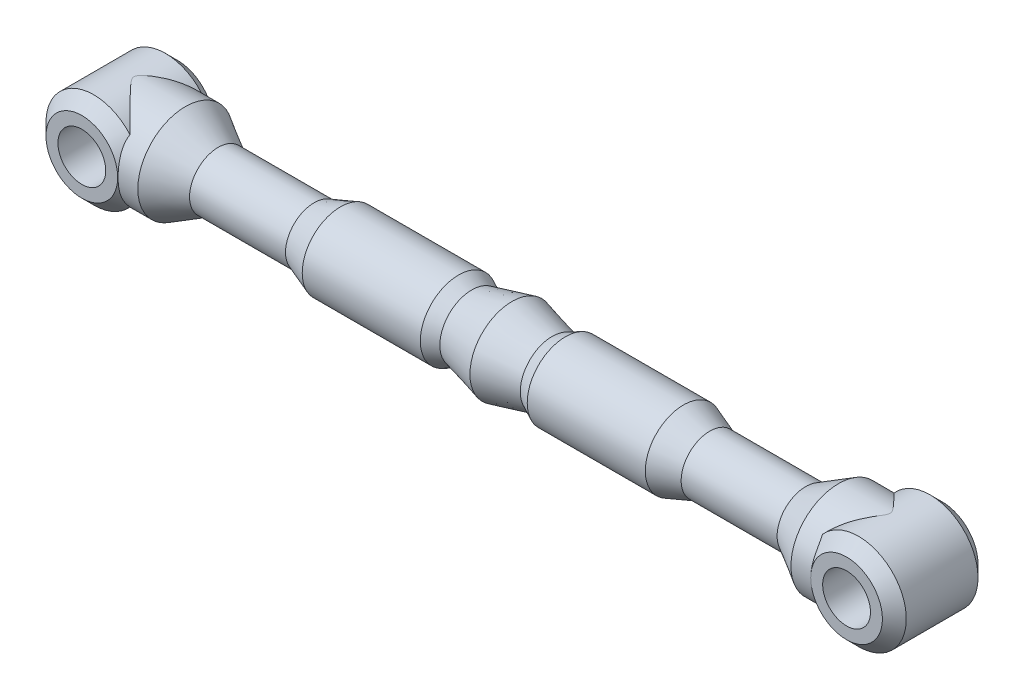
SolidWorks part; units mm, degrees
ref_plane "Front" through (0, 0, 0) normal (0, 0, 1) x (1, 0, 0)
ref_plane "Top" through (0, 0, 0) normal (0, 1, 0) x (1, 0, 0)
ref_plane "Right" through (0, 0, 0) normal (1, 0, 0) x (0, 0, -1)
sketch "Sketch4" plane through (0, 0, 0) normal (0, 0, 1) x (1, 0, 0)
  line L0 (-50.8, 0) -> (50.8, 0)
  line L1 (0, 0) -> (0, 5.588) construction
  line L2 (50.8, 0) -> (50.8, 6.3246)
  line L3 (-50.8, 0) -> (-50.8, 6.3246)
  line L4 (50.8, 6.3246) -> (43.3861, 6.3246)
  line L5 (-50.8, 6.3246) -> (-43.3861, 6.3246)
  line L6 (43.3861, 6.3246) -> (39.0307, 3.81)
  line L7 (-43.3861, 6.3246) -> (-39.0307, 3.81)
  line L8 (39.0307, 3.81) -> (26.2797, 3.81)
  line L9 (-39.0307, 3.81) -> (-26.2797, 3.81)
  line L10 (26.2797, 3.81) -> (22.7904, 5.08)
  line L11 (-26.2797, 3.81) -> (-22.7904, 5.08)
  line L12 (22.7904, 5.08) -> (7.1018, 5.08)
  line L13 (-22.7904, 5.08) -> (-7.1018, 5.08)
  line L14 (7.1018, 5.08) -> (5.3437, 4.2428)
  line L15 (-7.1018, 5.08) -> (-5.3437, 4.2428)
  line L16 (5.3437, 4.2428) -> (0, 5.588)
  line L17 (-5.3437, 4.2428) -> (0, 5.588)
  line L18 (-59.9497, 0) -> (59.9497, 0) construction
  point P6 (0, 0)
  point P24 (0, 0)
  dimension "D1" = 101.6
  dimension "D2" = 6.3246
revolve "Base-Revolve" add sketch "Sketch4" angle 360 about L18
sketch "Sketch5" plane through (0, 0, 0) normal (0, 0, 1) x (1, 0, 0)
  line L0 (-59.9497, 0) -> (59.9497, 0) construction
  line L1 (0, 0) -> (0, 11.9872) construction
  circle A0 centre (50.8, 0) radius 6.35
  circle A1 centre (-50.8, 0) radius 6.35
  dimension "D1" = 12.7
extrude "Boss-Extrude2" add sketch "Sketch5" along normal mid plane 12.7
sketch "Sketch6" plane through (0, 0, 0) normal (0, 0, 1) x (1, 0, 0)
  line L0 (0, 0) -> (0, 12.3753) construction
  circle A0 centre (50.8, 0) radius 3.175
  circle A1 centre (-50.8, 0) radius 3.175
  dimension "D1" = 6.35
extrude "Cut-Extrude1" cut sketch "Sketch6" against normal through all and the other way through all
chamfer "Chamfer1" distance 1.5875 angle 45 4 edges at (57.15, 0, -6.35) (57.15, 0, 6.35) (-57.15, 0, 6.35) (-57.15, 0, -6.35)
